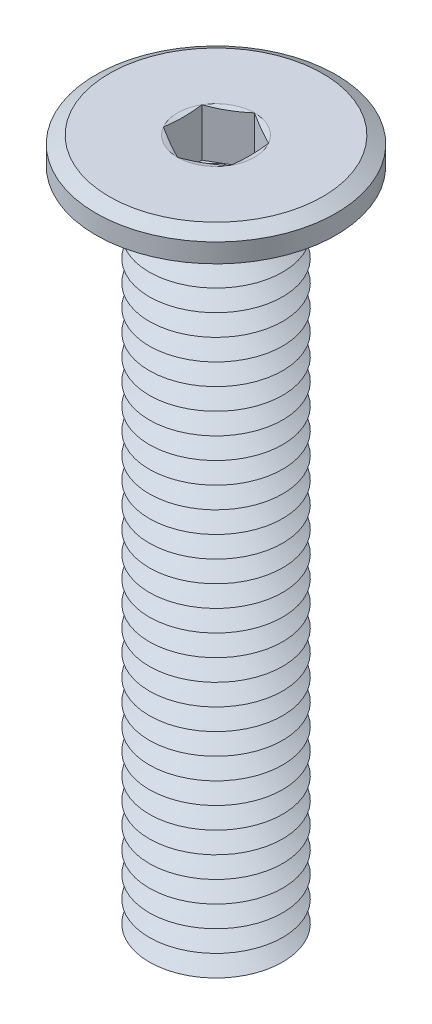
SolidWorks part; units mm, degrees
ref_plane "Front Plane" through (0, 0, 0) normal (0, 0, 1) x (1, 0, 0)
ref_plane "Top Plane" through (0, 0, 0) normal (0, 1, 0) x (1, 0, 0)
ref_plane "Right Plane" through (0, 0, 0) normal (1, 0, 0) x (0, 0, -1)
sketch "Sketch1" plane through (0, 0, 0) normal (0, 1, 0) x (1, 0, 0)
  circle A0 centre (0, 0) radius 4.5
  dimension "D1" = 9
extrude "Boss-Extrude1" add sketch "Sketch1" against normal blind 1
sketch "Sketch2" plane through (0, -1, 0) normal (0, -1, 0) x (1, 0, 0)
  circle A0 centre (0, 0) radius 2.5
  dimension "D1" = 5
extrude "Boss-Extrude2" add sketch "Sketch2" along normal blind 25
sketch "Sketch3" plane through (0, 0, 0) normal (1, 0, 0) x (0, 0, -1)
  line L0 (0, 0.9906) -> (0, -8.2999) construction
sketch "Sketch5" plane through (0, 0, 0) normal (1, 0, 0) x (0, 0, -1)
  line L0 (-2.5, -26.4) -> (-1.8072, -26)
  line L1 (-2.5, -1) -> (-2.5, -26) construction
  line L2 (-1.8072, -26) -> (-2.5, -25.6)
  line L3 (-2.5, -1) -> (-2.5, -26) construction
  line L4 (-2.5, -25.6) -> (-2.5, -26.4)
  line L6 (-2.5, -1) -> (-2.5, -26) construction
  line L7 (-2.5, -1) -> (-2.5, -26) construction
  line L14 (-2.5, -26) -> (2.5, -26) construction
  dimension "D1" = 0.8
revolve "Cut-Revolve1" cut sketch "Sketch5" angle 360 about L0
pattern_linear "LPattern1" count 30 spacing 0.8 along (0, 1, 0) of "Cut-Revolve1"
fillet "Fillet1" radius 0.2 1 edges at (0, -1, -2.5)
chamfer "Chamfer2" distance 0.5 angle 30 1 edges at (0, 0, 4.5)
sketch "Sketch6" plane through (0, 0, 0) normal (0, 1, 0) x (1, 0, 0)
  line L1 (0, 1.4434) -> (-1.25, 0.7217)
  line L2 (-1.25, 0.7217) -> (-1.25, -0.7217)
  line L3 (-1.25, -0.7217) -> (0, -1.4434)
  line L4 (0, -1.4434) -> (1.25, -0.7217)
  line L5 (1.25, -0.7217) -> (1.25, 0.7217)
  line L6 (1.25, 0.7217) -> (0, 1.4434)
  circle A0 centre (0, 0) radius 1.25 construction
  dimension "D1" = 2.5
extrude "Cut-Extrude1" cut sketch "Sketch6" against normal blind 1.8
sketch "Sketch7" plane through (0, -1.8, 0) normal (0, 1, 0) x (1, 0, 0)
  line L0 (-1.25, 0.7217) -> (-1.25, -0.7217) construction
  circle A0 centre (0, 0) radius 1.25
extrude "Cut-Extrude2" cut sketch "Sketch7" against normal through all draft 60
sketch "Sketch8" plane through (0, 0, 0) normal (0, 1, 0) x (1, 0, 0)
  circle A0 centre (0, 0) radius 1.4434
extrude "Cut-Extrude3" cut sketch "Sketch8" against normal through all draft 75
